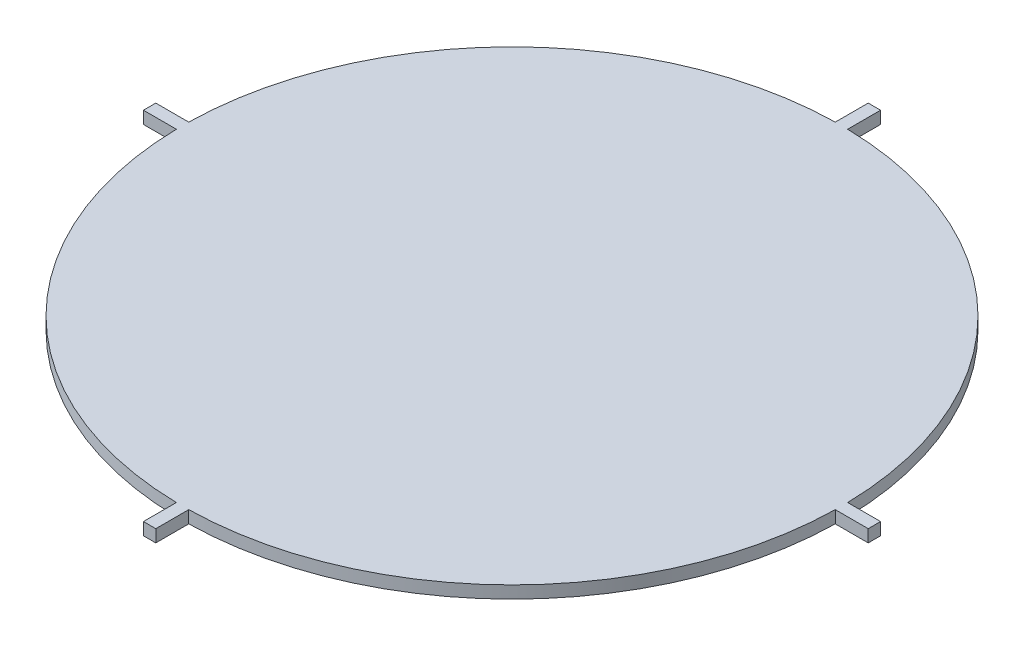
SolidWorks part; units mm, degrees
ref_plane "Front Plane" through (0, 0, 0) normal (0, 0, 1) x (1, 0, 0)
ref_plane "Top Plane" through (0, 0, 0) normal (0, 1, 0) x (1, 0, 0)
ref_plane "Right Plane" through (0, 0, 0) normal (1, 0, 0) x (0, 0, -1)
sketch "Sketch1" plane through (0, 0, 0) normal (0, 1, 0) x (1, 0, 0)
  line L0 (0, 0) -> (-29.8607, 0) construction
  line L1 (2.3553, 0) -> (0, 0) construction
  line L2 (0, 0) -> (0, -23.9022) construction
  line L3 (1.5, 87.9859) -> (1.5, 79.9859)
  line L4 (-147.992, 1.5) -> (-139.992, 1.5)
  line L5 (-147.992, 1.5) -> (-147.992, -1.5)
  line L6 (-147.992, -1.5) -> (-139.992, -1.5)
  line L7 (-1.5, 87.9859) -> (-1.5, 79.9859)
  line L8 (-127.9906, -1.5) -> (-119.9906, -1.5)
  line L9 (-127.9906, -1.5) -> (-127.9906, 1.5)
  line L10 (-127.9906, 1.5) -> (-119.9906, 1.5)
  line L11 (-1.5, 87.9859) -> (1.5, 87.9859)
  line L12 (-107.9887, -1.5) -> (-99.9887, -1.5)
  line L13 (-107.9887, -1.5) -> (-107.9887, 1.5)
  line L14 (-107.9887, 1.5) -> (-99.9887, 1.5)
  line L15 (-1.5, 107.9887) -> (-1.5, 99.9887)
  line L16 (-87.9859, -1.5) -> (-79.9859, -1.5)
  line L17 (-87.9859, -1.5) -> (-87.9859, 1.5)
  line L18 (-87.9859, 1.5) -> (-79.9859, 1.5)
  line L19 (1.5, 107.9887) -> (1.5, 99.9887)
  line L20 (-1.5, 107.9887) -> (1.5, 107.9887)
  line L21 (1.5, 127.9906) -> (1.5, 119.9906)
  line L22 (-1.5, 127.9906) -> (-1.5, 119.9906)
  line L23 (-1.5, 127.9906) -> (1.5, 127.9906)
  line L24 (1.5, 147.992) -> (1.5, 139.992)
  line L25 (-1.5, 147.992) -> (-1.5, 139.992)
  line L26 (87.9859, -1.5) -> (79.9859, -1.5)
  line L27 (87.9859, 1.5) -> (79.9859, 1.5)
  line L28 (87.9859, 1.5) -> (87.9859, -1.5)
  line L29 (107.9887, 1.5) -> (99.9887, 1.5)
  line L30 (107.9887, -1.5) -> (99.9887, -1.5)
  line L31 (107.9887, 1.5) -> (107.9887, -1.5)
  line L32 (127.9906, -1.5) -> (119.9906, -1.5)
  line L33 (127.9906, 1.5) -> (119.9906, 1.5)
  line L34 (127.9906, 1.5) -> (127.9906, -1.5)
  line L35 (147.992, -1.5) -> (139.992, -1.5)
  line L36 (147.992, 1.5) -> (139.992, 1.5)
  line L37 (-1.5, -87.9859) -> (-1.5, -79.9859)
  line L38 (1.5, -87.9859) -> (1.5, -79.9859)
  line L39 (1.5, -87.9859) -> (-1.5, -87.9859)
  line L40 (1.5, -107.9887) -> (1.5, -99.9887)
  line L41 (-1.5, -107.9887) -> (-1.5, -99.9887)
  line L42 (1.5, -107.9887) -> (-1.5, -107.9887)
  line L43 (-1.5, -127.9906) -> (-1.5, -119.9906)
  line L44 (1.5, -127.9906) -> (1.5, -119.9906)
  line L45 (1.5, -127.9906) -> (-1.5, -127.9906)
  line L46 (-1.5, -147.992) -> (-1.5, -139.992)
  line L47 (1.5, -147.992) -> (1.5, -139.992)
  line L48 (1.5, 87.9859) -> (1.5, 79.9859)
  line L49 (-1.5, 87.9859) -> (-1.5, 79.9859)
  line L50 (-1.5, 87.9859) -> (1.5, 87.9859)
  line L51 (-1.5, 107.9887) -> (-1.5, 99.9887)
  line L52 (1.5, 107.9887) -> (1.5, 99.9887)
  line L53 (-1.5, 107.9887) -> (1.5, 107.9887)
  line L54 (1.5, 127.9906) -> (1.5, 119.9906)
  line L55 (-1.5, 127.9906) -> (-1.5, 119.9906)
  line L56 (-1.5, 127.9906) -> (1.5, 127.9906)
  line L57 (1.5, 147.992) -> (1.5, 139.992)
  line L58 (-1.5, 147.992) -> (-1.5, 139.992)
  line L59 (1.5, 147.992) -> (-1.5, 147.992)
  line L60 (87.9859, -1.5) -> (79.9859, -1.5)
  line L61 (87.9859, 1.5) -> (79.9859, 1.5)
  line L62 (87.9859, 1.5) -> (87.9859, -1.5)
  line L63 (107.9887, 1.5) -> (99.9887, 1.5)
  line L64 (107.9887, -1.5) -> (99.9887, -1.5)
  line L65 (107.9887, 1.5) -> (107.9887, -1.5)
  line L66 (127.9906, -1.5) -> (119.9906, -1.5)
  line L67 (127.9906, 1.5) -> (119.9906, 1.5)
  line L68 (127.9906, 1.5) -> (127.9906, -1.5)
  line L69 (147.992, -1.5) -> (139.992, -1.5)
  line L70 (147.992, 1.5) -> (139.992, 1.5)
  line L71 (147.992, -1.5) -> (147.992, 1.5)
  line L72 (-1.5, -87.9859) -> (-1.5, -79.9859)
  line L73 (1.5, -87.9859) -> (1.5, -79.9859)
  line L74 (1.5, -87.9859) -> (-1.5, -87.9859)
  line L75 (1.5, -107.9887) -> (1.5, -99.9887)
  line L76 (-1.5, -107.9887) -> (-1.5, -99.9887)
  line L77 (1.5, -107.9887) -> (-1.5, -107.9887)
  line L78 (-1.5, -127.9906) -> (-1.5, -119.9906)
  line L79 (1.5, -127.9906) -> (1.5, -119.9906)
  line L80 (1.5, -127.9906) -> (-1.5, -127.9906)
  line L81 (-1.5, -147.992) -> (-1.5, -139.992)
  line L82 (1.5, -147.992) -> (1.5, -139.992)
  line L83 (-1.5, -147.992) -> (1.5, -147.992)
  arc A0 (-79.9859, -1.5) -> (-1.5, -79.9859) centre (0, 0) ccw
  arc A1 (-99.9887, -1.5) -> (-1.5, -99.9887) centre (0, 0) ccw
  arc A2 (-119.9906, -1.5) -> (-1.5, -119.9906) centre (0, 0) ccw
  arc A3 (-139.992, -1.5) -> (-1.5, -139.992) centre (0, 0) ccw
  arc A4 (1.5, -139.992) -> (139.992, -1.5) centre (0, 0) ccw
  arc A5 (1.5, -119.9906) -> (119.9906, -1.5) centre (0, 0) ccw
  arc A6 (1.5, -79.9859) -> (79.9859, -1.5) centre (0, 0) ccw
  arc A7 (1.5, -99.9887) -> (99.9887, -1.5) centre (0, 0) ccw
  arc A8 (-1.5, 79.9859) -> (-79.9859, 1.5) centre (0, 0) ccw
  arc A9 (-1.5, 99.9887) -> (-99.9887, 1.5) centre (0, 0) ccw
  arc A10 (-1.5, 119.9906) -> (-119.9906, 1.5) centre (0, 0) ccw
  arc A11 (-1.5, 139.992) -> (-139.992, 1.5) centre (0, 0) ccw
  arc A12 (79.9859, 1.5) -> (1.5, 79.9859) centre (0, 0) ccw
  arc A13 (99.9887, 1.5) -> (1.5, 99.9887) centre (0, 0) ccw
  arc A14 (119.9906, 1.5) -> (1.5, 119.9906) centre (0, 0) ccw
  arc A15 (139.992, 1.5) -> (1.5, 139.992) centre (0, 0) ccw
  point P71 (0, 0)
  point P97 (0, 0)
  point P146 (0, 0)
  dimension "D1" = 280
  dimension "D4" = 160
  dimension "D5" = 3
  dimension "D6" = 8
  dimension "D3" = 200
  dimension "D2" = 240
  dimension "D8" = 4
  dimension "D7" = 4
extrude "Boss-Extrude1" add sketch "Sketch1" along normal blind 3 contours L27 A12 L3 L11 L7 A8 L18 L17 L16 A0 L37 L39 L38 A6 L26 L28
